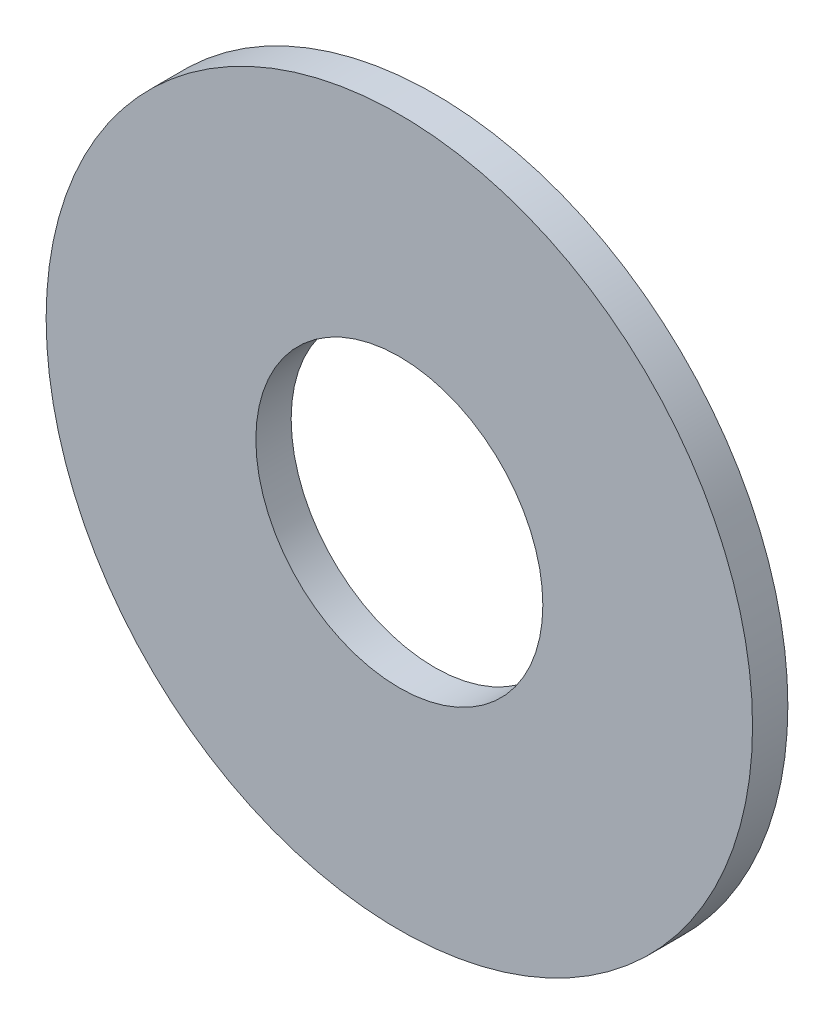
SolidWorks part; units mm, degrees
ref_plane "Front Plane" through (0, 0, 0) normal (0, 0, 1) x (1, 0, 0)
ref_plane "Top Plane" through (0, 0, 0) normal (0, 1, 0) x (1, 0, 0)
ref_plane "Right Plane" through (0, 0, 0) normal (1, 0, 0) x (0, 0, -1)
sketch "Sketch2" plane through (0, 0, 0) normal (0, 0, 1) x (1, 0, 0)
  circle A0 centre (0, 0) radius 25.4
  dimension "D1" = 50.8
extrude "Extrude1" add sketch "Sketch2" along normal blind 2.54
sketch "Sketch3" plane through (0, 0, 2.54) normal (0, 0, 1) x (1, 0, 0)
  circle A0 centre (0, 0) radius 10.3187
  dimension "D1" = 20.6375
extrude "Cut-Extrude1" cut sketch "Sketch3" against normal blind 2.54
